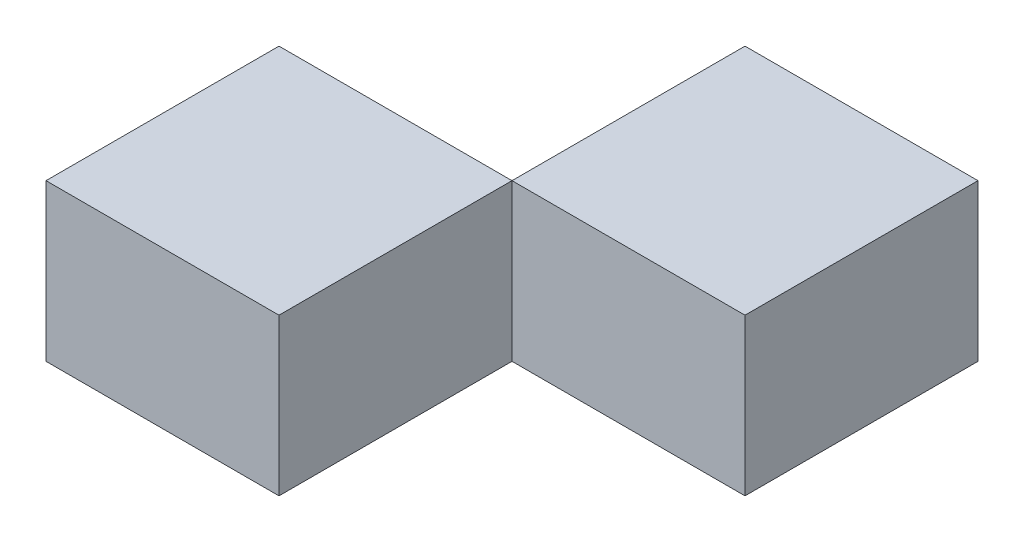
SolidWorks part; units mm, degrees
ref_plane "Front Plane" through (0, 0, 0) normal (0, 0, 1) x (1, 0, 0)
ref_plane "Top Plane" through (0, 0, 0) normal (0, 1, 0) x (1, 0, 0)
ref_plane "Right Plane" through (0, 0, 0) normal (1, 0, 0) x (0, 0, -1)
sketch "Sketch1" plane through (0, 0, 0) normal (0, 1, 0) x (1, 0, 0)
  line L1 (0, 0) -> (-20.8001, 0)
  line L2 (0, 0) -> (0, -20.8001)
  line L3 (0, -20.8001) -> (-20.8001, -20.8001)
  line L4 (-20.8001, 0) -> (-20.8001, -20.8001)
  line L5 (0, 0) -> (20.8001, 0)
  line L6 (0, 0) -> (0, 20.8001)
  line L7 (0, 20.8001) -> (20.8001, 20.8001)
  line L8 (20.8001, 0) -> (20.8001, 20.8001)
extrude "Extrude1" add sketch "Sketch1" along normal blind 13.97 contours L1 L4 L3 L2 | L5 L8 L7 L6
